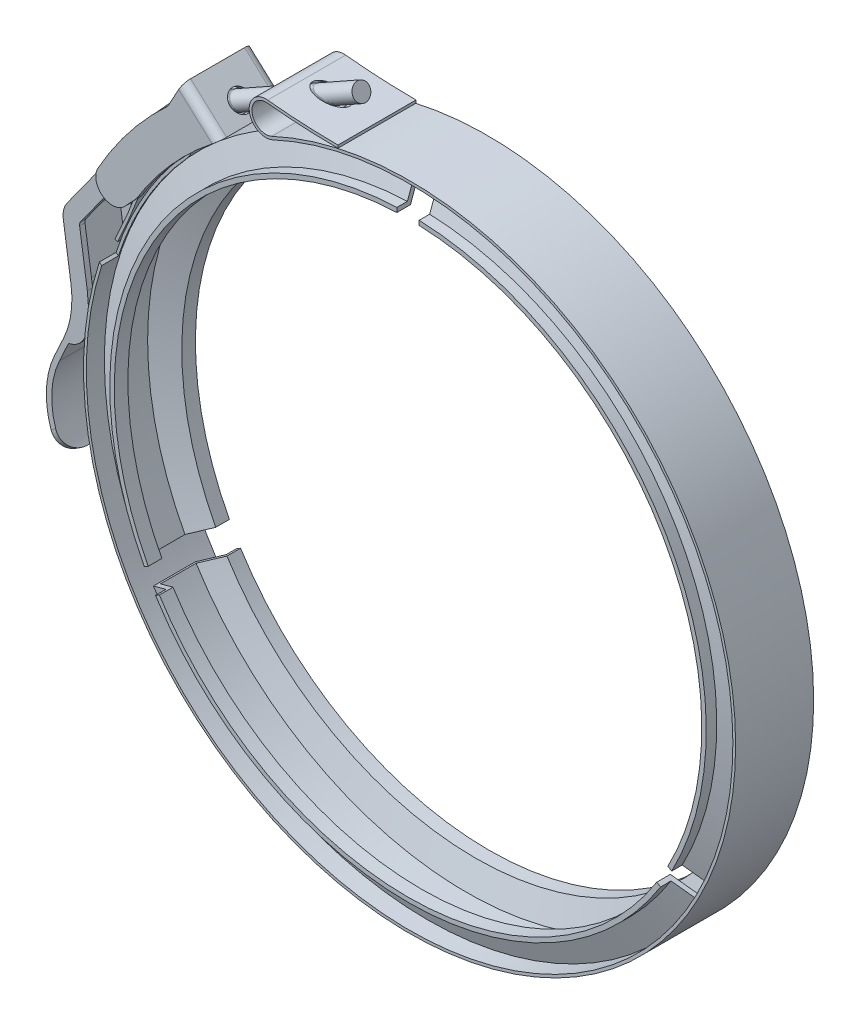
SolidWorks part; units mm, degrees
ref_plane "Front" through (0, 0, 0) normal (0, 0, 1) x (1, 0, 0)
ref_plane "Top" through (0, 0, 0) normal (0, 1, 0) x (1, 0, 0)
ref_plane "Right" through (0, 0, 0) normal (1, 0, 0) x (0, 0, -1)
sketch "Sketch1" plane through (0, 0, 0) normal (1, 0, 0) x (0, 0, -1)
  line L0 (-11.557, 84.9376) -> (-8.5671, 84.9376)
  line L1 (-11.1125, 92.8624) -> (11.1125, 92.8624)
  line L2 (-11.1125, 92.8624) -> (-11.1125, 92.075)
  line L3 (-11.1125, 92.075) -> (-5.9693, 92.075)
  line L4 (8.5671, 84.9376) -> (5.9693, 92.075)
  line L5 (-8.5671, 84.9376) -> (-5.9693, 92.075)
  line L6 (11.1125, 92.8624) -> (11.1125, 92.075)
  line L7 (11.557, 84.9376) -> (8.5671, 84.9376)
  line L8 (5.9693, 92.075) -> (11.1125, 92.075)
  line L9 (0, 0) -> (0, -21.5186) construction
  line L10 (-11.557, 83.6676) -> (-7.6778, 83.6676)
  line L11 (-7.6778, 83.6676) -> (-5.08, 90.805)
  line L12 (-5.08, 90.805) -> (5.08, 90.805)
  line L13 (-7.6778, 83.6676) -> (-4.7934, 91.5924) construction
  line L14 (7.6778, 83.6676) -> (4.7934, 91.5924) construction
  line L15 (-11.557, 84.9376) -> (-11.557, 83.6676)
  line L16 (11.557, 84.9376) -> (11.557, 83.6676)
  line L17 (7.6778, 83.6676) -> (5.08, 90.805)
  line L18 (11.557, 83.6676) -> (7.6778, 83.6676)
  line L19 (-4.7934, 91.5924) -> (4.7934, 91.5924) construction
  line L20 (-4.7934, 91.5924) -> (-4.7934, 91.5924) construction
  line L21 (-4.7934, 91.5924) -> (-4.7934, 91.5924) construction
  line L22 (4.7934, 91.5924) -> (4.7934, 91.5924) construction
  line L23 (4.7934, 91.5924) -> (4.7934, 91.5924) construction
  line L24 (0, 0) -> (-16.4298, 0) construction
  line L25 (-5.7734, 88.9) -> (5.7734, 88.9) construction
  line L26 (0, 62.9095) -> (0, -62.9095) construction
  point P28 (0, 88.9)
  dimension "D2" = 0.7874
  dimension "D3" = 22.225
  dimension "D4" = 1.27
  dimension "D5" = 40
  dimension "D6" = 23.114
  dimension "D7" = 7.1374
  dimension "D8" = 10.16
  dimension "D9" = 90.805
  dimension "D10" = 181.61
  dimension "D11" = 88.9
  dimension "D1" = 1.27
revolve "Revolve1" add sketch "Sketch1" angle 360 about L24
sketch "Sketch2" plane through (0, 0, 0) normal (0, 0, 1) x (1, 0, 0)
  line L0 (0, 0) -> (0, 92.0202) construction
  line L1 (0, 0) -> (-79.6919, -46.0101) construction
  line L2 (0, 0) -> (79.6919, -46.0101) construction
  line L3 (-1.5875, 2.7496) -> (-81.2794, -43.2605) construction
  line L4 (-3.175, 1.8331) -> (-81.2794, -43.2605)
  line L5 (0, -3.6662) -> (78.1044, -48.7598)
  line L6 (3.175, 1.8331) -> (3.175, 92.0202)
  line L7 (0, -3.6662) -> (-78.1044, -48.7598)
  line L8 (3.175, 1.8331) -> (81.2794, -43.2605)
  line L9 (-3.175, 1.8331) -> (-3.175, 92.0202)
  line L10 (-3.175, 0) -> (-3.175, 92.0202) construction
  line L11 (3.175, 0) -> (3.175, 92.0202) construction
  line L12 (1.5875, 2.7496) -> (81.2794, -43.2605) construction
  line L13 (-1.5875, -2.7496) -> (78.1044, -48.7598) construction
  line L14 (1.5875, -2.7496) -> (-78.1044, -48.7598) construction
  circle A0 centre (0, 0) radius 92.075 construction
  circle A2 centre (0, 0) radius 92.075 construction
  arc A3 (78.1044, -48.7598) -> (81.2794, -43.2605) centre (0, 0) ccw
  arc A4 (-81.2794, -43.2605) -> (-78.1044, -48.7598) centre (0, 0) ccw
  arc A5 (3.175, 92.0202) -> (-3.175, 92.0202) centre (0, 0) ccw
  dimension "D1" = 120
  dimension "D2" = 120
  dimension "D5" = 3.175
extrude "Cut-Extrude1" cut sketch "Sketch2" against normal mid plane 25.4
sketch "Sketch3" plane through (0, 0, 11.1125) normal (0, 0, 1) x (1, 0, 0)
  line L0 (0, 0) -> (-41.1524, 77.9898) construction
  line L1 (0, 0) -> (0, 69.6657) construction
  line L2 (-20.3904, 90.6482) -> (-20.3904, 91.4356)
  line L3 (0, 92.075) -> (0, 92.8624)
  line L4 (-87.9051, 27.3952) -> (-88.6568, 27.6295)
  line L5 (-87.9195, 31.4357) -> (-88.6712, 31.6699)
  line L6 (0, 0) -> (-40.9253, 87.7646) construction
  line L7 (0, 0) -> (-71.6133, 65.1846) construction
  line L8 (0, 0) -> (-63.5011, 19.7898) construction
  circle A0 centre (-40.9253, 87.7646) radius 3.9751 construction
  circle A1 centre (0, 0) radius 92.8624 construction
  circle A2 centre (-40.9253, 87.7646) radius 4.7625 construction
  circle A3 centre (0, 0) radius 92.075 construction
  arc A4 (0, 92.8624) -> (-39.2453, 84.1619) centre (0, 0) ccw
  arc A5 (0, 92.075) -> (-38.9126, 83.4483) centre (0, 0) ccw
  arc A6 (-40.4204, 92.5002) -> (-38.9126, 83.4483) centre (-40.9253, 87.7646) ccw
  arc A7 (-40.5039, 91.7173) -> (-39.2453, 84.1619) centre (-40.9253, 87.7646) ccw
  arc A8 (-40.5039, 91.7173) -> (-20.3904, 90.6482) centre (-20.3904, 280.3846) ccw
  arc A9 (-40.4204, 92.5002) -> (-20.3904, 91.4356) centre (-20.3904, 280.3846) ccw
  arc A10 (-76.2894, 66.088) -> (-88.6712, 31.6699) centre (-259.4395, 112.5398) cw
  arc A11 (-75.4678, 66.1564) -> (-87.9195, 31.4357) centre (-259.4395, 112.5398) cw
  arc A12 (-75.4678, 66.1564) -> (-68.6737, 62.5088) centre (-71.6133, 65.1846) cw
  arc A13 (-76.2894, 66.088) -> (-68.0914, 61.9788) centre (-71.6133, 65.1846) cw
  arc A14 (-87.9051, 27.3952) -> (-68.0914, 61.9788) centre (0, 0) cw
  arc A15 (-88.6568, 27.6295) -> (-68.6737, 62.5088) centre (0, 0) cw
  arc A16 (-3.175, 92.0202) -> (-81.2794, -43.2605) centre (0, 0) ccw construction
  dimension "D1" = 9.525
  dimension "D4" = 0.0508
  dimension "D7" = 188.949
  dimension "D6" = 0.508
  dimension "D5" = 25
  dimension "D2" = 38.1
  dimension "D8" = 25
  dimension "D9" = 3.8532
  dimension "D3" = 0.7874
extrude "Extrude3" add sketch "Sketch3" against normal blind 22.225
sketch "Sketch4" plane through (0, 0, 11.557) normal (0, 0, 1) x (1, 0, 0)
  arc A0 (-41.558, 83.0443) -> (-66.9186, 64.3843) centre (0, 0) ccw construction
  arc A1 (-3.175, 92.0202) -> (-81.2794, -43.2605) centre (0, 0) ccw construction
  arc A2 (-41.558, 83.0443) -> (-66.9186, 64.3843) centre (0, 0) ccw
  arc A4 (-40.4204, 92.5002) -> (-38.9126, 83.4483) centre (-40.9253, 87.7646) ccw construction
  arc A5 (-41.558, 83.0443) -> (-38.9126, 83.4483) centre (-40.9253, 87.7646) ccw
  arc A6 (-68.0914, 61.9788) -> (-76.2894, 66.088) centre (-71.6133, 65.1846) ccw construction
  arc A7 (-68.0914, 61.9788) -> (-66.9186, 64.3843) centre (-71.6133, 65.1846) ccw
  arc A8 (-38.9126, 83.4483) -> (-68.0914, 61.9788) centre (0, 0) ccw
extrude "Cut-Extrude2" cut sketch "Sketch4" against normal through all
sketch "Sketch5" plane through (0, 0, 0) normal (0, 0, 1) x (1, 0, 0)
  line L0 (-71.6133, 65.1846) -> (-40.9253, 87.7646) construction
  line L1 (-63.5905, 75.0296) -> (-27.7096, 95.1902) construction
  circle A0 centre (-63.5905, 75.0296) radius 3.175
  arc A1 (-68.6737, 62.5088) -> (-75.4678, 66.1564) centre (-71.6133, 65.1846) ccw construction
  dimension "D1" = 6.35
  dimension "D2" = 12.7
extrude "Extrude4" add sketch "Sketch5" along normal mid plane 15.875
ref_plane "Plane1" through (-63.5905, 75.0296, 0) normal (0.8718, 0.4898, 0) x (0, 0, -1)
sketch "Sketch6" plane through (-63.5905, 75.0296, 0) normal (0.8718, 0.4898, 0) x (0, 0, -1)
  circle A0 centre (0, 0) radius 2.413
  dimension "D1" = 4.826
extrude "Extrude6" add sketch "Sketch6" along normal blind 44.45 separate body
sketch "Sketch8" plane through (0, 0, 0) normal (0, 0, 1) x (1, 0, 0)
  line L0 (0, 0) -> (-77.4833, 70.5276) construction
  arc A0 (-68.6737, 62.5088) -> (-75.4678, 66.1564) centre (-71.6133, 65.1846) ccw construction
  point P3 (-71.6133, 65.1846)
  dimension "D1" = 7.9375
ref_plane "Plane2" through (-77.4833, 70.5276, 0) normal (-0.7395, 0.6731, 0) x (0, 0, 1)
sketch "Sketch9" plane through (-77.4833, 70.5276, 0) normal (-0.7395, 0.6731, 0) x (0, 0, 1)
  line L0 (-11.1125, -36.267) -> (11.1125, -36.267) construction
  line L1 (-15.2694, 7.7662) -> (-6.35, 7.7662)
  line L2 (-15.2694, 7.7662) -> (-15.2694, -38.299)
  line L3 (-15.2694, -38.299) -> (-6.35, -38.299)
  line L4 (-6.35, 7.7662) -> (-6.35, -38.299)
  line L5 (6.35, 7.8629) -> (13.265, 7.8629)
  line L6 (6.35, 7.8629) -> (6.35, -38.299)
  line L7 (6.35, -38.299) -> (13.265, -38.299)
  line L8 (13.265, 7.8629) -> (13.265, -38.299)
  dimension "D1" = 6.35
  dimension "D2" = 12.7
  dimension "D3" = 2.032
extrude "Cut-Extrude3" cut sketch "Sketch9" along normal up to surface (13.0281 mm away)
sketch "Sketch7" plane through (0, 0, 0) normal (0, 0, 1) x (1, 0, 0)
  line L0 (-63.5905, 75.0296) -> (-61.1034, 77.0032) construction
  line L1 (-64.0637, 80.7338) -> (-58.143, 73.2725)
  line L2 (0, 0) -> (-71.6133, 65.1846) construction
  line L4 (-71.6133, 65.1846) -> (-85.7607, 48.0439) construction
  arc A0 (-64.0637, 80.7338) -> (-89.9156, 50.3715) centre (0, 0) ccw
  arc A1 (-58.143, 73.2725) -> (-81.6057, 45.7163) centre (0, 0) ccw
  circle A2 centre (-63.5905, 75.0296) radius 3.175 construction
  arc A3 (-89.9156, 50.3715) -> (-81.6057, 45.7163) centre (-85.7607, 48.0439) ccw
  dimension "D1" = 9.525
  dimension "D2" = 22.225
sketch "Sketch10" plane through (-77.4833, 70.5276, 0) normal (-0.7395, 0.6731, 0) x (0, 0, 1)
  line L0 (8.4455, -27.07) -> (8.4455, 15.094)
  line L1 (7.6835, 15.856) -> (-7.6835, 15.856)
  line L2 (-8.4455, 15.094) -> (-8.4455, -27.07)
  line L3 (-8.4455, -27.07) -> (-9.9695, -27.07)
  line L4 (-9.9695, -27.07) -> (-9.9695, 15.094)
  line L5 (-7.6835, 17.38) -> (7.6835, 17.38)
  line L6 (9.9695, 15.094) -> (9.9695, -27.07)
  line L7 (9.9695, -27.07) -> (8.4455, -27.07)
  line L8 (7.9375, 15.856) -> (-7.9375, 15.856) construction
  line L9 (7.9375, 9.506) -> (7.9375, 15.856) construction
  line L10 (-7.9375, 15.856) -> (-7.9375, 9.506) construction
  arc A0 (8.4455, 15.094) -> (7.6835, 15.856) centre (7.6835, 15.094) ccw
  arc A1 (-7.6835, 15.856) -> (-8.4455, 15.094) centre (-7.6835, 15.094) ccw
  arc A2 (-9.9695, 15.094) -> (-7.6835, 17.38) centre (-7.6835, 15.094) cw
  arc A3 (7.6835, 17.38) -> (9.9695, 15.094) centre (7.6835, 15.094) cw
  dimension "D6" = 0.762
  dimension "D7" = 2.286
  dimension "D1" = 1.524
  dimension "D2" = 1.524
  dimension "D3" = 1.524
  dimension "D4" = 0.508
  dimension "D5" = 0.508
  dimension "D8" = 44.45
extrude "Extrude8" add sketch "Sketch10" against normal offset from surface (16.2612 mm away) 0.508 separate body
sketch "Sketch11" plane through (0, 0, 0) normal (0, 0, 1) x (1, 0, 0)
  line L0 (-73.0435, 54.6269) -> (-82.2893, 44.7834)
  line L1 (-73.0435, 54.6269) -> (-83.6795, 39.5628)
  line L2 (-69.9883, 75.6554) -> (-65.7842, 83.3805)
  line L3 (-65.7842, 83.3805) -> (-95.705, 50.5088)
  line L4 (-95.705, 50.5088) -> (-83.6795, 39.5628)
  arc A0 (-89.9156, 50.3715) -> (-81.6057, 45.7163) centre (-85.7607, 48.0439) ccw construction
  arc A1 (-64.0637, 80.7338) -> (-89.9156, 50.3715) centre (0, 0) ccw construction
  arc A2 (-89.9156, 50.3715) -> (-82.2893, 44.7834) centre (-85.7607, 48.0439) ccw
  arc A3 (-69.9883, 75.6554) -> (-89.9156, 50.3715) centre (0, 0) ccw
extrude "Cut-Extrude4" cut sketch "Sketch11" against normal mid plane 57.15
sketch "Sketch12" plane through (0, 0, 0) normal (0, 0, 1) x (1, 0, 0)
  line L0 (0, 0) -> (-101.8636, 31.7453) construction
  line L2 (-101.796, 30.8215) -> (-99.6114, 15.9655)
  line L3 (-101.687, 1.6086) -> (-104.2886, -4.0169)
  line L4 (-102.4928, -28.5797) -> (-101.2173, -27.7456)
  line L5 (-76.0063, 69.6688) -> (-100.6649, 35.4583)
  line L6 (-71.7319, 74.3648) -> (-70.6049, 73.3389)
  line L7 (0, 0) -> (-76.2177, 69.3756) construction
  line L8 (0, 0) -> (-89.9156, 50.3715) construction
  line L9 (-76.0063, 69.6688) -> (-71.7319, 74.3648)
  line L10 (-74.8208, 68.7072) -> (-70.6049, 73.3389)
  line L11 (-74.8208, 68.7072) -> (-99.4286, 34.5672)
  line L12 (-100.2882, 31.0432) -> (-98.1036, 16.1873)
  line L13 (-100.3038, 0.9689) -> (-102.9053, -4.6566)
  line L14 (-104.2886, -4.0169) -> (-81.2345, -14.6785) construction
  line L15 (-81.2345, -14.6785) -> (-101.2173, -27.7456) construction
  arc A0 (-99.6114, 15.9655) -> (-101.687, 1.6086) centre (-124.7411, 12.2701) cw
  arc A1 (-104.2886, -4.0169) -> (-102.4928, -28.5797) centre (-81.2345, -14.6785) ccw
  arc A2 (-100.2882, 31.0432) -> (-99.4286, 34.5672) centre (-95.5136, 31.7453) cw
  arc A3 (-101.796, 30.8215) -> (-100.6649, 35.4583) centre (-95.5136, 31.7453) cw
  circle A4 centre (0, 0) radius 107.95 construction
  arc A6 (-98.1036, 16.1873) -> (-100.3038, 0.9689) centre (-124.7411, 12.2701) cw
  arc A7 (-102.9053, -4.6566) -> (-101.2173, -27.7456) centre (-81.2345, -14.6785) ccw
  arc A10 (-69.9883, 75.6554) -> (-89.9156, 50.3715) centre (0, 0) ccw construction
  point P5 (-100.7037, 23.3935)
  point P13 (-98.5103, 8.4778)
  point P17 (-71.6133, 65.1846)
  point P24 (-107.95, 0)
  dimension "D3" = 6.526
  dimension "D5" = 25.4
  dimension "D6" = 6.35
  dimension "D11" = 215.9
  dimension "D4" = 60.325
  dimension "D7" = 25.4
  dimension "D8" = 6.35
  dimension "D9" = 6.7091
  dimension "D2" = 25
  dimension "D12" = 44.149
  dimension "D13" = 58
  dimension "D10" = 1.524
extrude "Extrude9" add sketch "Sketch12" along normal mid plane 15.875
sketch "Sketch13" plane through (0, 0, 7.9375) normal (0, 0, 1) x (1, 0, 0)
  line L0 (-98.1036, 16.1873) -> (-100.2882, 31.0432) construction
  line L1 (-74.8208, 68.7072) -> (-70.6049, 73.3389) construction
  line L2 (-99.4286, 34.5672) -> (-74.8208, 68.7072) construction
  line L3 (-98.1036, 16.1873) -> (-100.2882, 31.0432)
  line L4 (-74.8208, 68.7072) -> (-70.6049, 73.3389)
  line L5 (-99.4286, 34.5672) -> (-74.8208, 68.7072)
  arc A0 (-100.3038, 0.9689) -> (-98.1036, 16.1873) centre (-124.7411, 12.2701) ccw construction
  arc A1 (-99.4286, 34.5672) -> (-100.2882, 31.0432) centre (-95.5136, 31.7453) ccw construction
  arc A2 (-100.3038, 0.9689) -> (-98.1036, 16.1873) centre (-124.7411, 12.2701) ccw
  arc A3 (-99.4286, 34.5672) -> (-100.2882, 31.0432) centre (-95.5136, 31.7453) ccw
sketch "Sketch14" plane through (4.5161, 4.9615, 0) normal (0.6731, 0.7395, 0) x (-0.7395, 0.6731, 0)
  line L1 (101.5807, 7.9375) -> (98.4057, 7.9375)
  line L2 (101.5807, 7.9375) -> (101.5807, 6.4135)
  line L3 (101.5807, 6.4135) -> (98.4057, 6.4135)
  line L4 (98.4057, 7.9375) -> (98.4057, 6.4135)
  line L5 (101.5807, -7.9375) -> (98.4057, -7.9375)
  line L6 (101.5807, -7.9375) -> (101.5807, -6.4135)
  line L7 (101.5807, -6.4135) -> (98.4057, -6.4135)
  line L8 (98.4057, -7.9375) -> (98.4057, -6.4135)
  dimension "D1" = 1.524
  dimension "D2" = 3.175
sweep "Sweep1" add profiles "Sketch14" path "Sketch13"
fillet "Fillet2" radius 6.35 4 edges at (-101.8551, -28.1626, -7.9375) (-101.8551, -28.1626, 7.9375) (-97.422, -0.3638, -7.1755) (-97.422, -0.3638, 7.1755)
sketch "Sketch15" plane through (22.4615, 12.6206, 0) normal (0.8718, 0.4898, 0) x (0, 0, -1)
  circle A0 centre (0, 96.561) radius 2.921
  circle A1 centre (0, 96.561) radius 2.413 construction
  circle A2 centre (0, 96.561) radius 2.413
  dimension "D1" = 0.508
extrude "Cut-Extrude7" cut sketch "Sketch15" against normal up to surface (43.2057 mm away)
ref_plane "LEVER TIP Plane3" through (0, 0, 0) normal (0.2686, -0.9633, 0) x (0.9633, 0.2686, 0)
equation "\"D4@Sketch1\" = \"D1@Sketch1\""
equation "\"D1@Sketch9\" = \"D2@Sketch9\"/2"
equation "\"D3@Sketch10\" = \"D2@Sketch10\""
equation "\"D5@Sketch10\" = \"D4@Sketch10\""
